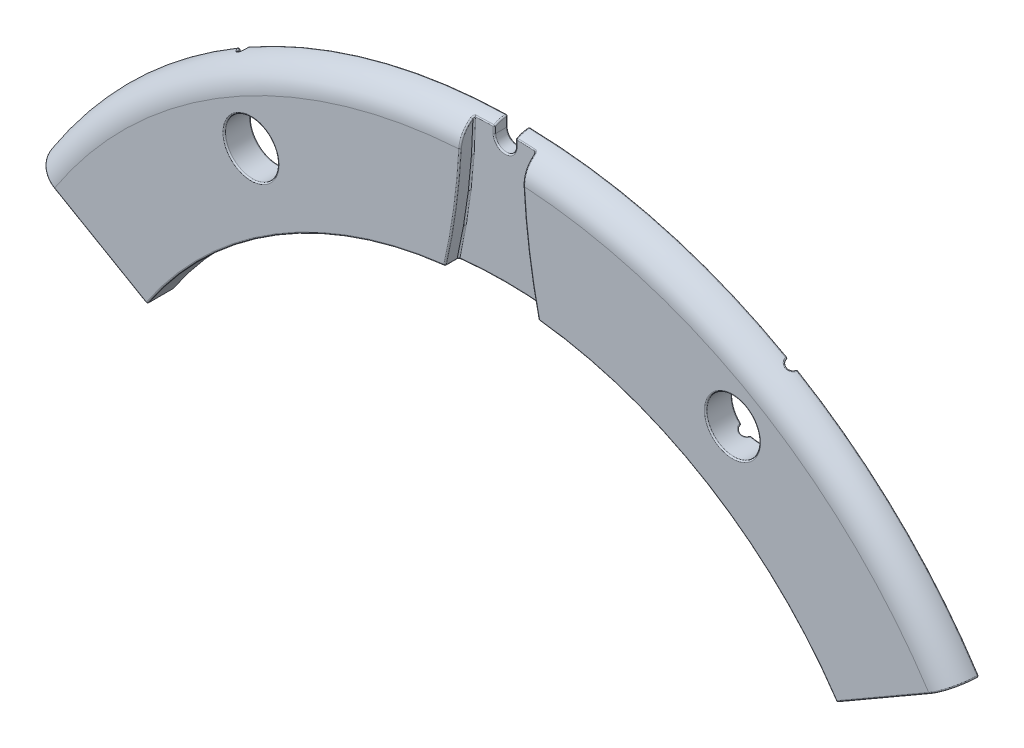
SolidWorks part; units mm, degrees
ref_plane "Спереди" through (0, 0, 0) normal (0, 0, 1) x (1, 0, 0)
ref_plane "Сверху" through (0, 0, 0) normal (0, 1, 0) x (1, 0, 0)
ref_plane "Справа" through (0, 0, 0) normal (1, 0, 0) x (0, 0, -1)
sketch "Эскиз1" plane through (0, 0, 0) normal (0, 0, 1) x (1, 0, 0)
  line L0 (-177.5352, 102.5) -> (0, 0) construction
  line L1 (0, 0) -> (177.5352, 102.5) construction
  line L2 (0, 0) -> (0, 205) construction
  line L3 (128.9543, 85.9988) -> (172.3239, 111.0382)
  line L4 (-128.9543, 85.9988) -> (-172.3239, 111.0382)
  line L5 (-90, 155.8846) -> (0, 0) construction
  line L6 (0, 0) -> (90, 155.8846) construction
  arc A0 (172.3239, 111.0382) -> (-172.3239, 111.0382) centre (0, 0) ccw
  arc A1 (128.9543, 85.9988) -> (-128.9543, 85.9988) centre (0, 0) ccw
  arc A2 (150.6438, 98.5213) -> (-150.6438, 98.5213) centre (0, 0) ccw construction
  circle A3 centre (0, 0) radius 205 construction
  circle A4 centre (0, 0) radius 180 construction
  circle A5 centre (0, 0) radius 155 construction
  circle A6 centre (-90, 155.8846) radius 10
  circle A7 centre (90, 155.8846) radius 10
  dimension "D1" = 410
  dimension "D8" = 20
  dimension "D4" = 60
  dimension "D5" = 120
  dimension "D6" = 10
  dimension "D7" = 10
  dimension "D9" = 30
  dimension "D10" = 30
  dimension "D2" = 50
  dimension "D3" = 25
extrude "Бобышка-Вытянуть1" add sketch "Эскиз1" along normal blind 10
fillet "Скругление1" radius 10 1 edges at (0, 205, 10)
fillet "Скругление2" radius 0.5 15 edges at (146.3035, 96.0154, 10) (170.4278, 109.9435, 6.2413) (150.6391, 98.5185, 0) (-150.6391, 98.5185, 0) (-169.0748, 109.1624, 7.8039) (-146.3035, 96.0154, 10) (-128.9543, 85.9988, 5) (0, 155, 10) (128.9543, 85.9988, 5) (0, 155, 0) (100, 155.8846, 0) (100, 155.8846, 10) (-80, 155.8846, 0) (-80, 155.8846, 10) (0, 205, 0)
sketch "Эскиз2" plane through (0, 0, 10) normal (0, 0, 1) x (1, 0, 0)
  line L0 (0, 204.9861) -> (0, 155) construction
  line L1 (11.5, 222.9574) -> (11.5, 188.2023) construction
  line L2 (17.5, 164.772) -> (17.5, 139.7796) construction
  arc A0 (172.0262, 111.4733) -> (-172.0262, 111.4733) centre (0, 0) ccw construction
  arc A1 (128.6944, 86.3871) -> (-128.6944, 86.3871) centre (0, 0) ccw construction
  arc A2 (11.5, 204.6633) -> (-11.5, 204.6633) centre (0, 0) ccw
  arc A3 (17.5, 154.0089) -> (-17.5, 154.0089) centre (0, 0) ccw
  arc A4 (11.5, 204.6633) -> (17.5, 154.0089) centre (251.4843, 207.4069) ccw
  arc A5 (-11.5, 204.6633) -> (-17.5, 154.0089) centre (-251.4843, 207.4069) cw
  point P13 (11.5, 204.6633)
  point P14 (17.5, 154.0089)
  dimension "D3" = 480
  dimension "D1" = 11.5
  dimension "D2" = 17.5
extrude "Вырез-Вытянуть1" cut sketch "Эскиз2" against normal blind 5
fillet "Скругление3" radius 0.5 12 edges at (-13.7557, 174.4658, 10) (13.7557, 174.4658, 10) (17.4766, 154.1115, 9.799) (-17.4657, 154.1593, 9.8527) (-11.5649, 201.1874, 7.5826) (11.578, 200.7015, 7.9735) (17.5, 154.0089, 7.25) (-17.5, 154.0089, 7.25) (0, 203.6603, 5) (13.2295, 178.5164, 5) (0, 155, 5) (-13.2295, 178.5164, 5)
ref_plane "Плоскость1" through (0, 0, 0) normal (0.5, -0.866, 0) x (0.866, 0.5, 0)
sketch "Эскиз3" plane through (0, 0, 0) normal (0.5, -0.866, 0) x (0.866, 0.5, 0)
  circle A0 centre (0, 0) radius 2
  dimension "D1" = 4
extrude "Вырез-Вытянуть2" cut sketch "Эскиз3" against normal through all
ref_plane "Плоскость2" through (0, 0, 0) normal (0.5, 0.866, 0) x (-0.866, 0.5, 0)
sketch "Эскиз4" plane through (0, 0, 0) normal (0.5, 0.866, 0) x (-0.866, 0.5, 0)
  circle A0 centre (0, 0) radius 2
  dimension "D1" = 4
extrude "Вырез-Вытянуть3" cut sketch "Эскиз4" along normal through all
fillet "Скругление4" radius 0.5 32 edges at (-86.7605, 146.2872, 0.1644) (-83.3302, 148.31, 0.2102) (-96.6698, 163.4591, 0.2102) (-93.2395, 165.4819, 0.1644) (-75.8413, 135.351, 0.1421) (-79.2702, 133.3187, 0.1931) (-84.9454, 147.2561, 1.999) (-102.2487, 177.4487, 1.9924) (-100.7205, 178.4306, 0.2117) (-95.0546, 164.5131, 1.999) (-104.131, 176.3677, 0.122) (-100.4283, 169.9468, 0) (-96.9642, 171.9468, 0) (-79.5628, 141.8068, 0) (-83.0269, 139.8068, 0) (-77.4457, 134.2653, 1.999) (83.3302, 148.31, 0.2102) (86.7605, 146.2872, 0.1644) (93.2395, 165.4819, 0.1644) (96.6698, 163.4591, 0.2102) (77.4457, 134.2653, 1.999) (79.5628, 141.8068, 0) (83.0269, 139.8068, 0) (100.4283, 169.9468, 0) (96.9642, 171.9468, 0) (104.131, 176.3677, 0.122) (102.2487, 177.4487, 1.9924) (100.7205, 178.4306, 0.2117) (95.0546, 164.5131, 1.999) (79.2702, 133.3187, 0.1931) (84.9454, 147.2561, 1.999) (75.8413, 135.351, 0.1421)
sketch "Эскиз5" plane through (0, 0, 0) normal (1, 0, 0) x (0, 0, -1)
  line L0 (-10, 205) -> (10, 205) construction
  line L1 (10, 205) -> (10, 201) construction
  line L2 (-10, 201) -> (10, 201) construction
  line L3 (-10, 201) -> (-10, 205) construction
  line L4 (-10, 205) -> (10, 205)
  line L5 (10, 205) -> (10, 201)
  line L6 (-10, 201) -> (10, 201)
  line L7 (-10, 201) -> (-10, 205)
revolve "Вырез-Повернуть1" cut sketch "Эскиз5" angle 360 about L6
sketch "Эскиз6" plane through (0, 0, 0) normal (0, 0, 1) x (1, 0, 0)
  line L3 (-4, 205) -> (-4, 201)
  line L4 (4, 205) -> (-4, 205)
  line L5 (4, 201) -> (4, 205)
  line L6 (-4, 205) -> (-4, 201)
  line L7 (4, 205) -> (-4, 205)
  line L8 (4, 201) -> (4, 205)
  arc A1 (-4, 201) -> (4, 201) centre (0, 201) ccw
  arc A2 (-4, 201) -> (4, 201) centre (0, 201) ccw
  dimension "D1" = 0
extrude "Вырез-Вытянуть5" cut sketch "Эскиз6" along normal blind 10
fillet "Скругление5" radius 0.5 12 edges at (4, 202.7239, 0) (4, 204.7306, 0.0877) (4, 185.6945, -3.7693) (4, 203.6829, 4.8515) (4, 202.1636, 5) (-4, 202.1636, 5) (-4, 203.4477, 4.9853) (-4, 185.292, -2.5675) (-4, 204.8106, 0.156) (-4, 202.7239, 0) (0, 197, 5) (0, 197, 0)
